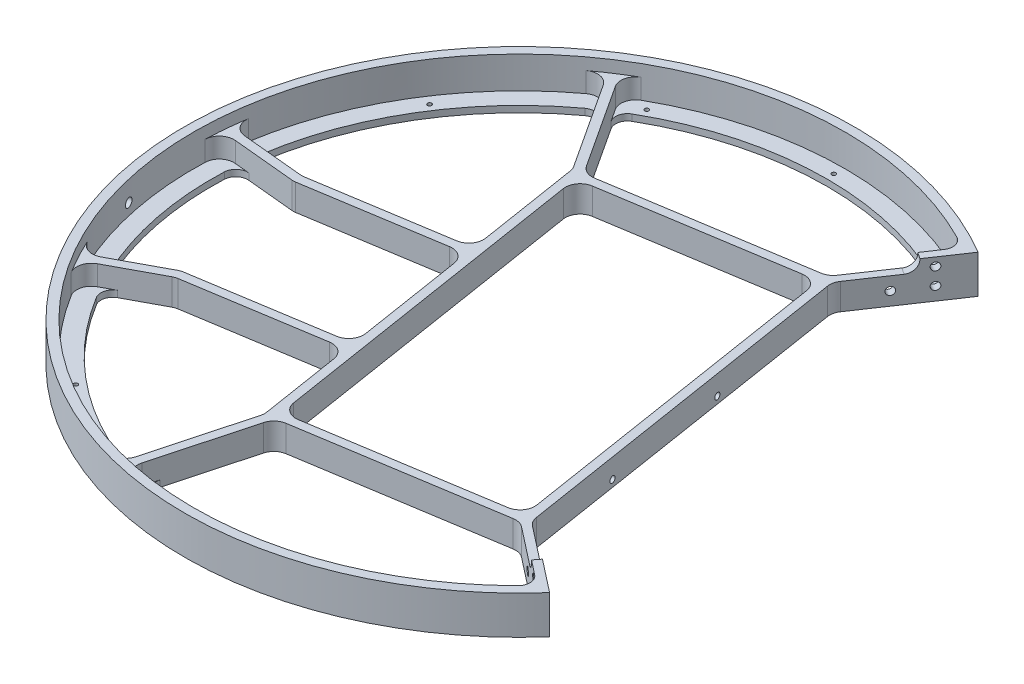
SolidWorks part; units mm, degrees
ref_plane "Front" through (0, 0, 0) normal (0, 0, 1) x (1, 0, 0)
ref_plane "Top" through (0, 0, 0) normal (0, 1, 0) x (1, 0, 0)
ref_plane "Right" through (0, 0, 0) normal (1, 0, 0) x (0, 0, -1)
ref_axis "center" through (0, 49.397, 0) along (0, -1, 0)
sketch "Sketch1" plane through (0, 0, 0) normal (0, 1, 0) x (1, 0, 0)
  circle A0 centre (0, 0) radius 180.34
  circle A1 centre (0, 0) radius 185.42
  dimension "D1" = 370.84
  dimension "D2" = 360.68
extrude "Extrude1" add sketch "Sketch1" along normal blind 21.209
sketch "Sketch2" plane through (0, 0, 0) normal (0, -1, 0) x (1, 0, 0)
  circle A0 centre (0, 0) radius 170.4519
  circle A1 centre (0, 0) radius 185.42
  circle A2 centre (0, 0) radius 185.42 construction
extrude "Extrude2" add sketch "Sketch2" against normal blind 3.556
sketch "Sketch3" plane through (0, 21.209, 0) normal (0, 1, 0) x (-1, 0, 0)
  line L1 (-139.2191, 122.4689) -> (14.5786, 2.309)
  line L2 (14.5786, 2.309) -> (-94.5602, -159.4959)
  line L4 (0, 0) -> (-213.3969, 0) construction
  arc A0 (-139.2191, 122.4689) -> (-94.5602, -159.4959) centre (0, 0) ccw
  circle A1 centre (0, 0) radius 185.42 construction
  dimension "D1" = 2.309
  dimension "D2" = 14.5786
  dimension "D3" = 38
  dimension "D4" = 94
extrude "Cut-Extrude1" cut sketch "Sketch3" against normal through all
sketch "Sketch5" plane through (0, 3.556, 0) normal (0, 1, 0) x (-1, 0, 0)
  line L0 (-86.1747, -147.0639) -> (-91.7146, -155.277) construction
  line L1 (-81.5982, -140.2789) -> (-78.0184, -142.6935)
  line L2 (-81.5982, -140.2789) -> (-91.7146, -155.277)
  line L5 (-78.0184, -142.6935) -> (-87.9609, -157.4338)
  arc A0 (-91.7146, -155.277) -> (-87.9609, -157.4338) centre (0, 0) ccw
  arc A1 (-91.7146, -155.277) -> (-135.209, 119.3359) centre (0, 0) ccw construction
  dimension "D1" = 17.78
  dimension "D2" = 4.318
extrude "Extrude4" add sketch "Sketch5" along normal up to surface and the other way up to surface
sketch "Sketch6" plane through (0, 3.556, 0) normal (0, 1, 0) x (-1, 0, 0)
  line L0 (-135.209, 119.3359) -> (-121.1981, 108.3894)
  line L1 (-135.209, 119.3359) -> (-127.4023, 113.2366) construction
  line L2 (-135.209, 119.3359) -> (-132.5505, 122.7385)
  line L3 (-132.5505, 122.7385) -> (-118.5397, 111.792)
  line L4 (-121.1981, 108.3894) -> (-118.5397, 111.792)
  dimension "D1" = 17.78
  dimension "D2" = 4.318
extrude "Extrude5" add sketch "Sketch6" along normal up to surface and the other way up to surface
fillet "Fillet1" radius 6.604 4 edges at (87.9609, 12.3825, -157.4338) (82.4109, 1.778, -149.2056) (132.3055, 12.3825, 122.547) (124.4845, 1.778, 116.4366)
sketch "Sketch7" plane through (0, 0, 0) normal (0, -1, 0) x (1, 0, 0)
  line L0 (93.4219, 86.6883) -> (62.0614, -111.3144)
  line L2 (62.0614, -111.3144) -> (91.7146, -155.277)
  line L3 (93.4219, 86.6883) -> (135.209, 119.3359)
  line L6 (-122.325, 68.3104) -> (-157.7895, 87.3212)
  line L7 (-160.0696, 83.0678) -> (-123.8859, 63.6714)
  line L8 (-121.9654, 68.1176) -> (-124.2455, 63.8642) construction
  line L9 (0, 0) -> (-176.4986, 94.6124) construction
  line L10 (0, 0) -> (-186.5492, -17.8863) construction
  line L11 (-41.313, 50.5932) -> (-53.0744, -23.6651)
  line L12 (-179.731, -14.8085) -> (-135.6671, -10.5837)
  line L13 (-135.8166, -15.4462) -> (-179.2704, -19.6125)
  line L14 (0, 0) -> (-47.0282, 174.1001) construction
  line L15 (-135.9722, -10.6129) -> (-135.5116, -15.4169) construction
  line L16 (88.3221, 85.3394) -> (57.6723, -108.1762)
  line L17 (58.0749, -113.1261) -> (87.9609, -157.4338)
  line L18 (83.8607, -151.3551) -> (78.285, -143.0887) construction
  line L19 (90.4953, 89.8814) -> (132.3055, 122.547)
  line L20 (-32.0181, 109.279) -> (-40.5581, 55.3598)
  line L21 (139.2191, 122.4689) -> (94.5602, -159.4959) construction
  line L22 (-53.0749, -23.6683) -> (-48.3083, -24.4233) construction
  line L23 (0, 0) -> (-98.6574, -150.961) construction
  line L24 (-58.9368, -94.5933) -> (58.0749, -113.1261)
  line L25 (-58.6553, -89.7517) -> (57.6723, -108.1762)
  line L26 (-100.6685, -149.6275) -> (-64.1824, -93.7981)
  line L27 (-58.9368, -94.5933) -> (-96.6287, -152.2676)
  line L28 (121.1981, 108.3894) -> (139.2191, 122.4689) construction
  line L29 (-32.0181, 109.279) -> (-49.3535, 173.4553)
  line L30 (57.6723, -108.1762) -> (56.9173, -112.9428) construction
  line L31 (94.5602, -159.4959) -> (81.5982, -140.2789) construction
  line L32 (62.0614, -111.3144) -> (-63.6114, -91.4098) construction
  line L33 (-63.2339, -89.0265) -> (-63.9889, -93.7931) construction
  line L35 (-44.6945, 174.7138) -> (-26.7976, 108.4587)
  line L36 (118.6703, 111.8941) -> (126.5276, 118.0328) construction
  line L39 (90.4953, 89.8814) -> (-26.7976, 108.4587)
  line L40 (-28.0055, 103.7639) -> (-58.6553, -89.7517)
  line L41 (88.3221, 85.3394) -> (-28.0055, 103.7639)
  line L44 (-40.5581, 55.3598) -> (-122.325, 68.3104)
  line L45 (-41.313, 50.5932) -> (-123.8859, 63.6714)
  line L46 (-122.728, 68.3742) -> (-123.4829, 63.6076) construction
  line L47 (-53.0744, -23.6651) -> (-135.6671, -10.5837)
  line L48 (-53.8293, -28.4317) -> (-135.8166, -15.4462)
  line L49 (-135.3644, -10.6316) -> (-136.1193, -15.3982) construction
  line L50 (-53.8293, -28.4317) -> (-64.1824, -93.7981)
  arc A0 (127.1167, 127.9213) -> (81.3653, -160.9416) centre (0, 0) ccw construction
  arc A1 (-179.731, -14.8085) -> (-179.2704, -19.6125) centre (0, 0) ccw
  circle A2 centre (-123.1055, 65.9909) radius 1.5875 construction
  circle A3 centre (-135.7419, -13.0149) radius 1.5875 construction
  circle A6 centre (-50.6916, -24.0458) radius 1.5875 construction
  arc A7 (-157.7895, 87.3212) -> (-160.0696, 83.0678) centre (0, 0) ccw
  arc A8 (-44.6945, 174.7138) -> (-49.3535, 173.4553) centre (0, 0) ccw
  arc A9 (135.209, 119.3359) -> (132.3055, 122.547) centre (0, 0) ccw
  arc A10 (-100.6685, -149.6275) -> (-96.6287, -152.2676) centre (0, 0) ccw
  arc A11 (87.9609, -157.4338) -> (91.7146, -155.277) centre (0, 0) ccw
  circle A12 centre (-135.7419, -13.0149) radius 1.5875 construction
  point P25 (-123.1055, 65.9909)
  point P36 (-135.7419, -13.0149)
  point P51 (-50.6916, -24.0458)
  point P86 (-123.1055, 65.9909)
  point P91 (-135.7419, -13.0149)
  dimension "D1" = 200.4708
  dimension "D2" = 2.413
  dimension "web thk" = 4.826
  dimension "D3" = 2.413
  dimension "D4" = 64.1763
  dimension "D5" = 98.1054
extrude "Extrude6" add sketch "Sketch7" against normal blind 14.605
fillet "Fillet2" radius 8.128 28 edges at (-28.0055, 7.3025, 103.7639) (-58.6553, 7.3025, -89.7517) (88.3221, 7.3025, 85.3394) (57.6723, 7.3025, -108.1762) (90.4953, 7.3025, 89.8814) (-26.7976, 7.3025, 108.4587) (-44.6945, 9.0805, 174.7138) (-49.3535, 9.0805, 173.4553) (-32.0181, 7.3025, 109.279) (-40.5581, 7.3025, 55.3598) (-122.325, 7.3025, 68.3104) (-157.7895, 9.0805, 87.3212) (-160.0696, 9.0805, 83.0678) (-123.8859, 7.3025, 63.6714) (-41.313, 7.3025, 50.5932) (-53.0744, 7.3025, -23.6651) (-135.6671, 7.3025, -10.5837) (-179.731, 9.0805, -14.8085) (-179.2704, 9.0805, -19.6125) (-135.8166, 7.3025, -15.4462) (-53.8293, 7.3025, -28.4317) (-64.1824, 7.3025, -93.7981) (-100.6685, 9.0805, -149.6275) (-96.6287, 9.0805, -152.2676) (93.4219, 7.3025, 86.6883) (62.0614, 7.3025, -111.3144) (-58.9368, 7.3025, -94.5933) (58.0749, 7.3025, -113.1261)
fillet "Fillet3" [suppressed] radius 6.35
sketch "Sketch15" plane through (0, 0, 0) normal (0, -1, 0) x (1, 0, 0)
  line L0 (62.5623, -108.1521) -> (92.9211, 83.526) construction
  line L1 (-53.7399, -95.4164) -> (54.5843, -112.5732) construction
  circle A0 centre (59.6781, -110.9369) radius 2.413
  dimension "D1" = 4.826
  dimension "D2" = 2.413
  dimension "D3" = 2.413
extrude "Extrude7" add sketch "Sketch15" along normal blind 4.191
pattern_linear "LPattern5" count 3 spacing 61.2775 along (-0.9877, 0, 0.1564) count 4 spacing 66.8274 along (0.1564, 0, 0.9877) of "Extrude7"
sketch "Sketch16" plane through (0, 0, 0) normal (0, -1, 0) x (1, 0, 0)
  line L0 (0, 0) -> (82.0411, -154.2969) construction
  line L1 (0, 0) -> (77.7417, -12.3131) construction
  line L2 (72.5155, -45.3098) -> (82.9696, 20.6949) construction
  circle A0 centre (82.0411, -154.2969) radius 2.413
  circle A1 centre (59.6781, -110.9369) radius 2.413 construction
  dimension "D1" = 53
  dimension "D2" = 174.752
extrude "Extrude8" add sketch "Sketch16" along normal up to surface (4.191 mm away)
pattern_circular "CirPattern3" count 10 over 253.822 about axis through (0, 0, 0) along (0, 1, 0) of "Extrude8"
sketch "Sketch17" plane through (0, 0, 0) normal (0, -1, 0) x (1, 0, 0)
  line L0 (-29.277, 95.736) -> (-57.3838, -81.7238) construction
  circle A0 centre (-50.6916, -24.0458) radius 2.413
  circle A1 centre (-39.1714, 48.6897) radius 2.413
  circle A2 centre (-123.2248, 65.9909) radius 2.413
  circle A3 centre (-135.7381, -13.0149) radius 2.413
  circle A4 centre (59.6781, -110.9369) radius 2.413 construction
  dimension "D2" = 2.413
  dimension "D3" = 88.138
  dimension "D4" = 88.138
  dimension "D7" = 65.9909
  dimension "D8" = 13.0149
  dimension "D1" = 2.413
  dimension "D5" = 48.6897
  dimension "D6" = 24.0458
extrude "Extrude9" add sketch "Sketch17" along normal up to surface (4.191 mm away)
hole_wizard "#4-40 Tapped Hole4" positions "Sketch19" profile "Sketch18" tap size "#4-40" standard "Ansi Inch"
sketch "Sketch19" plane through (0, -4.191, 0) normal (0, -1, 0) x (1, 0, 0)
  circle A0 centre (125.3283, 121.7829) radius 2.413 construction
  circle A1 centre (52.8966, 166.5539) radius 2.413 construction
  circle A2 centre (-32.0946, 171.7795) radius 2.413 construction
  circle A3 centre (-109.4654, 136.2189) radius 2.413 construction
  circle A4 centre (-160.8455, 68.3154) radius 2.413 construction
  circle A5 centre (-145.9036, -96.1789) radius 2.413 construction
  circle A6 centre (-0.6175, -174.7509) radius 2.413 construction
  circle A7 centre (-83.1294, -153.7133) radius 2.413 construction
  circle A8 centre (82.0411, -154.2969) radius 2.413 construction
  point P0 (125.3283, 121.7829)
  point P1 (52.8966, 166.5539)
  point P2 (-32.0946, 171.7795)
  point P3 (-109.4654, 136.2189)
  point P4 (-160.8455, 68.3154)
  point P5 (-145.9036, -96.1789)
  point P6 (-83.1294, -153.7133)
  point P7 (-0.6175, -174.7509)
  point P8 (82.0411, -154.2969)
sketch "Sketch18" plane through (125.3283, -4.191, 121.7829) normal (1, 0, 0) x (0, 0, -1)
  line L0 (0, 0) -> (0, 25.4)
  line L1 (0, 25.4) -> (1.1303, 25.4)
  line L2 (1.1303, 25.4) -> (1.1303, 0)
  line L5 (1.1303, 0) -> (0, 0)
  line L11 (0, -6.35) -> (0, 107.95) construction
  dimension "Thru Tap Drill Dia." = 2.2606
  dimension "Thru Tap Drill Depth" = 25.4
hole_wizard "#4-40 Tapped Hole5" positions "Sketch21" profile "Sketch20" tap size "#4-40" standard "Ansi Inch"
sketch "Sketch21" plane through (0, -4.191, 0) normal (0, -1, 0) x (1, 0, 0)
  circle A0 centre (91.0404, 87.077) radius 2.413 construction
  circle A1 centre (30.5174, 96.6629) radius 2.413 construction
  circle A2 centre (-30.0057, 106.2488) radius 2.413 construction
  circle A3 centre (-39.1714, 48.6897) radius 2.413 construction
  circle A4 centre (-123.2248, 65.9909) radius 2.413 construction
  circle A5 centre (-135.7381, -13.0149) radius 2.413 construction
  circle A6 centre (-174.0355, -15.8085) radius 2.413 construction
  circle A7 centre (80.5863, 21.0724) radius 2.413 construction
  circle A8 centre (70.1322, -44.9323) radius 2.413 construction
  circle A10 centre (59.6781, -110.9369) radius 2.413 construction
  circle A11 centre (-0.845, -101.351) radius 2.413 construction
  circle A12 centre (-61.368, -91.7651) radius 2.413 construction
  circle A13 centre (-50.6916, -24.0458) radius 2.413 construction
  point P0 (-30.0057, 106.2488)
  point P2 (-123.2248, 65.9909)
  point P3 (-135.7381, -13.0149)
  point P5 (-61.368, -91.7651)
  point P6 (-0.845, -101.351)
  point P7 (59.6781, -110.9369)
  point P8 (70.1322, -44.9323)
  point P9 (80.5863, 21.0724)
  point P10 (-50.6916, -24.0458)
  point P11 (-39.1714, 48.6897)
  point P12 (30.5174, 96.6629)
  point P13 (91.0404, 87.077)
  point P14 (-174.0355, -15.8085)
sketch "Sketch20" plane through (-30.0057, -4.191, 106.2488) normal (1, 0, 0) x (0, 0, -1)
  line L0 (0, 0) -> (0, 14.5222)
  line L1 (0, 14.5222) -> (1.1303, 13.843)
  line L2 (1.1303, 13.843) -> (1.1303, 0)
  line L5 (1.1303, 0) -> (0, 0)
  line L10 (0, 14.5222) -> (-1.1303, 13.843) construction
  line L11 (0, -6.35) -> (0, 107.95) construction
  dimension "Tap Drill Dia." = 2.2606
  dimension "Tap Drill Depth" = 13.843
  dimension "Drill Angle" = 118
fillet "Fillet4" radius 6.35 2 edges at (119.8689, 14.605, 110.0907) (79.8083, 14.605, -141.4862)
sketch "Sketch22" plane through (0, 0, 0) normal (0, 1, 0) x (1, 0, 0)
  circle A0 centre (0, 0) radius 204.0541
extrude "Cut-Extrude2" cut sketch "Sketch22" against normal through all
fillet "Fillet5" radius 6.604 8 edges at (-42.1157, 1.778, 165.167) (-46.7747, 1.778, 163.9085) (-149.0738, 1.778, 82.6491) (-151.3538, 1.778, 78.3957) (-169.8871, 1.778, -13.8647) (-169.4265, 1.778, -18.6687) (-95.2586, 1.778, -141.3495) (-91.2188, 1.778, -143.9896)
hole_wizard "#18 (0.1695) Diameter Hole1" positions "Sketch24" profile "Sketch23" hole size "#18" standard "Ansi Inch"
sketch "Sketch24" plane through (-12.5292, 0, -8.4511) normal (-0.829, 0, -0.5592) x (-0.5592, 0, 0.829)
  circle A0 centre (-168.148, 16.637) radius 1.7272 construction
  circle A2 centre (-168.148, 7.3025) radius 1.7272 construction
  circle A4 centre (-150.114, 7.3025) radius 1.7272 construction
  point P0 (-150.114, 7.3025)
  point P1 (-168.148, 16.637)
  point P3 (-168.148, 7.3025)
sketch "Sketch23" plane through (71.4134, 7.3025, -132.9012) normal (0, 1, 0) x (-0.5592, 0, 0.829)
  line L0 (0, 0) -> (0, 234.2164)
  line L1 (0, 234.2164) -> (2.1526, 234.2164)
  line L2 (2.1526, 234.2164) -> (2.1526, 0)
  line L5 (2.1526, 0) -> (0, 0)
  line L11 (0, -6.35) -> (0, 107.95) construction
  dimension "Thru Hole Dia." = 4.3053
  dimension "Thru Hole Depth" = 234.2164
hole_wizard "#18 (0.1695) Diameter Hole2" positions "Sketch26" profile "Sketch25" hole size "#18" standard "Ansi Inch"
sketch "Sketch26" plane through (-9.3045, 0, 11.9092) normal (-0.6157, 0, 0.788) x (0.788, 0, 0.6157)
  circle A0 centre (150.114, 7.3025) radius 1.7272 construction
  circle A1 centre (168.148, 7.3025) radius 1.7272 construction
  circle A2 centre (168.148, 16.637) radius 1.7272 construction
  point P0 (168.148, 16.637)
  point P1 (150.114, 7.3025)
  point P3 (168.148, 7.3025)
sketch "Sketch25" plane through (123.1979, 16.637, 115.4315) normal (0, 1, 0) x (0.788, 0, 0.6157)
  line L0 (0, 0) -> (0, 246.9378)
  line L1 (0, 246.9378) -> (2.1526, 246.9378)
  line L2 (2.1526, 246.9378) -> (2.1526, 0)
  line L5 (2.1526, 0) -> (0, 0)
  line L11 (0, -6.35) -> (0, 107.95) construction
  dimension "Thru Hole Dia." = 4.3053
  dimension "Thru Hole Depth" = 246.9378
sketch "Sketch27" plane through (-48.1191, 0, 7.6213) normal (-0.9877, 0, 0.1564) x (0.1564, 0, 0.9877)
  line L0 (-23.5484, 14.605) -> (35.3795, 14.605)
  point P0 (0, 0)
ref_plane "Plane1" through (-48.1191, 0, 7.6213) normal (0.9877, 0, -0.1564) x (-0.1564, 0, -0.9877)
ref_plane "Third Mount Plane" through (-186.0992, 0, 29.4752) normal (0.9877, 0, -0.1564) x (-0.1564, 0, -0.9877)
sketch "Sketch28" plane through (-186.0992, 0, 29.4752) normal (0.9877, 0, -0.1564) x (-0.1564, 0, -0.9877)
  line L1 (97.0337, 0) -> (-97.0337, 0) construction
  circle A0 centre (-12.7, 9.906) radius 2.413
  point P0 (-12.7, 9.906)
  dimension "D4" = 4.826
  dimension "D1" = 12.7
  dimension "D2" = 9.906
extrude "Cut-Extrude4" cut sketch "Sketch28" along normal up to surface (8.3726 mm away)
ref_plane "Normal Plane" through (0, 0, 0) normal (-0.1564, 0, -0.9877) x (-0.9877, 0, 0.1564)
sketch "Sketch36" plane through (77.7417, 0, -12.3131) normal (0.9877, 0, -0.1564) x (-0.1564, 0, -0.9877)
  line L0 (97.0337, 14.605) -> (-97.0337, 14.605) construction
  line L1 (-97.0337, 14.605) -> (-97.0337, 0) construction
  circle A0 centre (-46.2337, 3.81) radius 1.7272
  circle A1 centre (23.6163, 3.81) radius 1.7272
  dimension "D1" = 3.4544
  dimension "D4" = 69.85
  dimension "D2" = 10.795
  dimension "D3" = 10.795
  dimension "D5" = 50.8
extrude "Cut-Extrude5" cut sketch "Sketch36" against normal up to next
